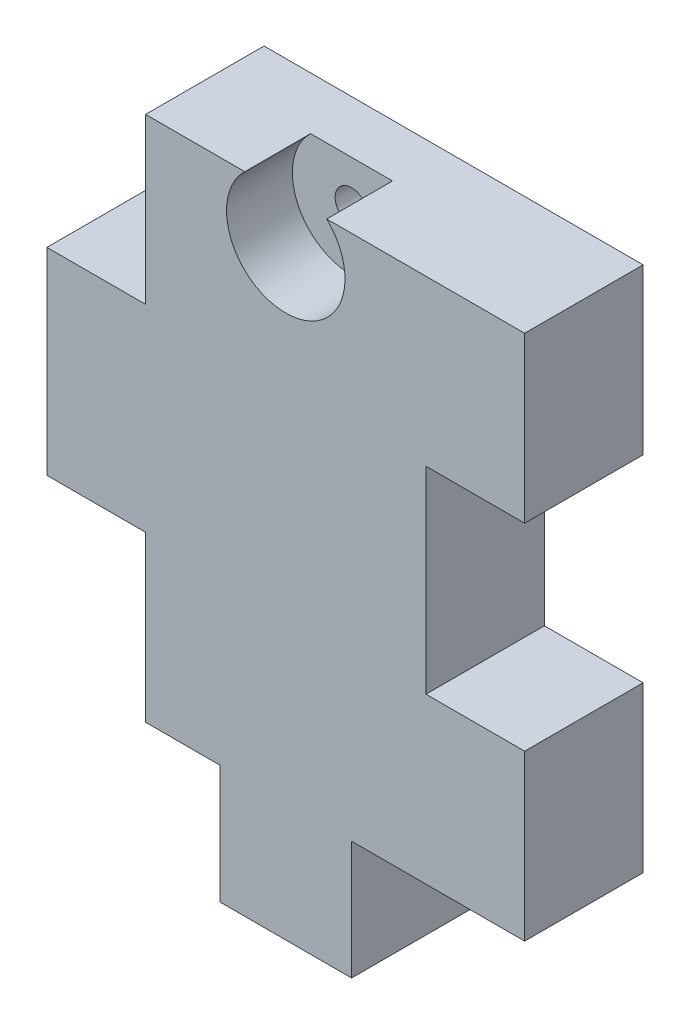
SolidWorks part; units mm, degrees
ref_plane "Front Plane" through (0, 0, 0) normal (0, 0, 1) x (1, 0, 0)
ref_plane "Top Plane" through (0, 0, 0) normal (0, 1, 0) x (1, 0, 0)
ref_plane "Right Plane" through (0, 0, 0) normal (1, 0, 0) x (0, 0, -1)
sketch "Sketch1" plane through (0, 0, 0) normal (0, 0, 1) x (1, 0, 0)
  line L0 (0, 0) -> (62.4838, 0) construction
  line L1 (-21.3, -40) -> (21.3, -40)
  line L2 (-21.3, -40) -> (-21.3, -15) construction
  line L3 (-21.3, 40) -> (21.3, 40)
  line L4 (21.3, -15) -> (21.3, 15) construction
  line L5 (-21.3, -40) -> (21.3, 40) construction
  line L6 (-21.3, 40) -> (21.3, -40) construction
  line L7 (21.3, 40) -> (36.3, 40)
  line L8 (21.3, 15) -> (21.3, -15)
  line L9 (21.3, -40) -> (36.3, -40)
  line L10 (36.3, 40) -> (36.3, 15)
  line L11 (36.3, -15) -> (36.3, -40)
  line L12 (-36.3, 15) -> (-36.3, -15)
  line L13 (-21.3, 15) -> (-21.3, 40) construction
  line L14 (-21.3, 40) -> (-21.3, 15)
  line L15 (-58.7101, 15) -> (-21.3, 15) construction
  line L16 (-58.7101, -15) -> (-15.8196, -15) construction
  line L17 (-36.3, 15) -> (-21.3, 15)
  line L18 (21.3, 15) -> (36.3, 15)
  line L19 (-21.3, -15) -> (-36.3, -15)
  line L20 (21.3, -15) -> (36.3, -15)
  line L21 (-21.3, -15) -> (-21.3, -40)
  line L22 (-20.4405, 15) -> (984.1804, 15) construction
  point P0 (0, 0)
  dimension "D1" = 80
  dimension "D2" = 42.6
  dimension "D3" = 15
  dimension "D4" = 15
  dimension "D5" = 15
extrude "Boss-Extrude1" add sketch "Sketch1" along normal blind 18
sketch "Sketch2" plane through (0, 0, 18) normal (0, 0, 1) x (1, 0, 0)
  line L0 (0, 40) -> (0, 33.5) construction
  circle A0 centre (0, 33.5) radius 9
  dimension "D2" = 18
  dimension "D1" = 6.5
extrude "Cut-Extrude1" cut sketch "Sketch2" against normal blind 10
sketch "Sketch3" plane through (0, 0, 18) normal (0, 0, 1) x (1, 0, 0)
  line L0 (-21.3, -40) -> (36.3, -40) construction
  line L1 (-10, -58) -> (10, -58)
  line L2 (-10, -58) -> (-10, -35)
  line L4 (10, -58) -> (10, -35)
  line L5 (-10, -58) -> (7.5, -40) construction
  line L6 (7.5, -40) -> (10, -58) construction
  line L7 (-10, -35) -> (10, -35)
  point P0 (7.5, -40)
  dimension "D1" = 18
  dimension "D2" = 20
extrude "Boss-Extrude2" add sketch "Sketch3" against normal blind 18
sketch "Sketch6" plane through (0, 0, 18) normal (0, 0, 1) x (1, 0, 0)
  circle A0 centre (0, 33.5) radius 2.5
  dimension "D1" = 5
extrude "Cut-Extrude2" cut sketch "Sketch6" against normal through all both and the other way through all
